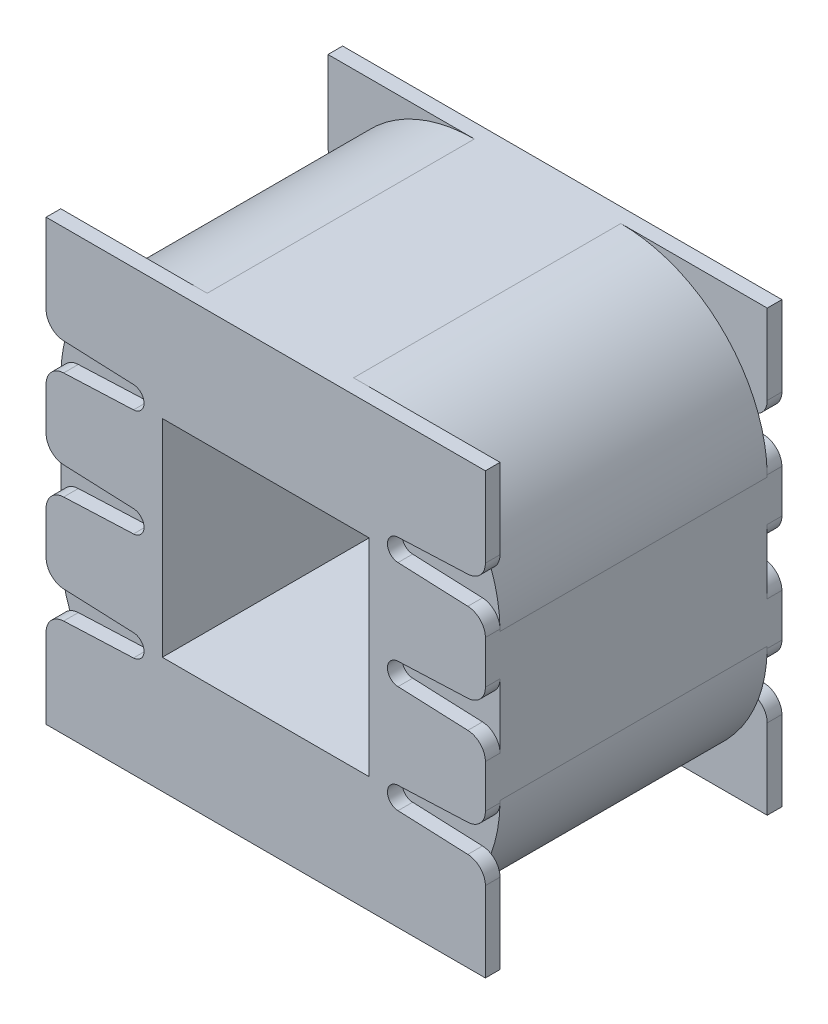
SolidWorks part; units mm, degrees
ref_plane "Face" through (0, 0, 0) normal (0, 0, 1) x (1, 0, 0)
ref_plane "Dessus" through (0, 0, 0) normal (0, 1, 0) x (1, 0, 0)
ref_plane "Droite" through (0, 0, 0) normal (1, 0, 0) x (0, 0, -1)
sketch "Esquisse1" plane through (0, 0, 0) normal (0, 0, 1) x (1, 0, 0)
  line L0 (0, 0) -> (42.7473, 0) construction
  line L1 (-12, 12) -> (12, 12)
  line L2 (-12, 12) -> (-12, 7.629)
  line L3 (-12, -12) -> (12, -12)
  line L4 (12, 12) -> (12, 7.629)
  line L5 (0, 0) -> (0, 46.2729) construction
  line L6 (7.2254, 0.6) -> (11.0419, 0.7599)
  line L7 (-5.65, 5.65) -> (5.65, 5.65)
  line L8 (-5.65, 5.65) -> (-5.65, -5.65)
  line L9 (-5.65, -5.65) -> (5.65, -5.65)
  line L10 (5.65, 5.65) -> (5.65, -5.65)
  line L11 (12, -1.759) -> (12, -4.111)
  line L12 (7.2254, -0.6) -> (11.0419, -0.7599)
  line L13 (7.2254, 6.47) -> (11.0419, 6.6299)
  line L14 (7.2254, 5.27) -> (11.0419, 5.1101)
  line L15 (7.2254, -5.27) -> (11.0419, -5.1101)
  line L16 (7.2254, -6.47) -> (11.0419, -6.6299)
  line L17 (12, 4.111) -> (12, 1.759)
  line L18 (12, -7.629) -> (12, -12)
  line L19 (-7.2254, -6.47) -> (-11.0419, -6.6299)
  line L20 (-7.2254, -5.27) -> (-11.0419, -5.1101)
  line L21 (-7.2254, -0.6) -> (-11.0419, -0.7599)
  line L22 (-7.2254, 0.6) -> (-11.0419, 0.7599)
  line L23 (-7.2254, 5.27) -> (-11.0419, 5.1101)
  line L24 (-7.2254, 6.47) -> (-11.0419, 6.6299)
  line L25 (-12, 4.111) -> (-12, 1.759)
  line L26 (-12, -1.759) -> (-12, -4.111)
  line L27 (-12, -7.629) -> (-12, -12)
  arc A0 (7.2254, 0.6) -> (7.2254, -0.6) centre (7.2505, 0) ccw
  arc A1 (11.0419, 0.7599) -> (12, 1.759) centre (11, 1.759) ccw
  arc A2 (11.0419, -0.7599) -> (12, -1.759) centre (11, -1.759) cw
  arc A3 (7.2254, 6.47) -> (7.2254, 5.27) centre (7.2505, 5.87) ccw
  arc A4 (11.0419, 6.6299) -> (12, 7.629) centre (11, 7.629) ccw
  arc A5 (11.0419, 5.1101) -> (12, 4.111) centre (11, 4.111) cw
  arc A6 (7.2254, -5.27) -> (7.2254, -6.47) centre (7.2505, -5.87) ccw
  arc A7 (11.0419, -5.1101) -> (12, -4.111) centre (11, -4.111) ccw
  arc A8 (11.0419, -6.6299) -> (12, -7.629) centre (11, -7.629) cw
  arc A9 (-11.0419, -6.6299) -> (-12, -7.629) centre (-11, -7.629) ccw
  arc A10 (-11.0419, -5.1101) -> (-12, -4.111) centre (-11, -4.111) cw
  arc A11 (-7.2254, -5.27) -> (-7.2254, -6.47) centre (-7.2505, -5.87) cw
  arc A12 (-11.0419, -0.7599) -> (-12, -1.759) centre (-11, -1.759) ccw
  arc A13 (-11.0419, 0.7599) -> (-12, 1.759) centre (-11, 1.759) cw
  arc A14 (-7.2254, 0.6) -> (-7.2254, -0.6) centre (-7.2505, 0) cw
  arc A15 (-11.0419, 5.1101) -> (-12, 4.111) centre (-11, 4.111) ccw
  arc A16 (-11.0419, 6.6299) -> (-12, 7.629) centre (-11, 7.629) cw
  arc A17 (-7.2254, 6.47) -> (-7.2254, 5.27) centre (-7.2505, 5.87) cw
  point P6 (0, 12)
  point P13 (0, 5.65)
  point P14 (5.65, 0)
  point P21 (12, 0.8)
  dimension "D3" = 1
  dimension "D6" = 1
  dimension "D1" = 24
  dimension "D2" = 11.3
  dimension "D4" = 1.2
  dimension "D5" = 1.6
extrude "Extrusion1" add sketch "Esquisse1" along normal blind 16.2
ref_plane "Plan1" through (0, 0, 8.1) normal (0, 0, 1) x (1, 0, 0)
sketch "Esquisse2" plane through (0, 0, 8.1) normal (0, 0, 1) x (1, 0, 0)
  line L8 (6.65, 6.65) -> (-6.65, 6.65)
  line L9 (-6.65, 6.65) -> (-6.65, -6.65)
  line L10 (-6.65, -6.65) -> (6.65, -6.65)
  line L11 (6.65, -6.65) -> (6.65, 6.65)
extrude "Enlèv. mat.-Extru.1" cut sketch "Esquisse2" against normal offset from surface 0.8 and the other way offset from surface (7.3 mm away) 0.8 flip side to cut
sketch "Esquisse3" plane through (0, 0, 8.1) normal (0, 0, 1) x (1, 0, 0)
  line L0 (-5.65, 5.65) -> (-5.65, -5.65) construction
  line L1 (-5.65, -5.65) -> (5.65, -5.65) construction
  line L2 (5.65, -5.65) -> (5.65, 5.65) construction
  line L3 (5.65, 5.65) -> (-5.65, 5.65) construction
  line L4 (-5.65, 5.65) -> (-5.65, -5.65)
  line L5 (-5.65, -5.65) -> (5.65, -5.65)
  line L6 (5.65, -5.65) -> (5.65, 5.65)
  line L7 (5.65, 5.65) -> (-5.65, 5.65)
  line L8 (-12, -12) -> (12, -12) construction
  line L9 (12, 7.629) -> (12, 12) construction
  line L10 (-12, 12) -> (-12, 7.629) construction
  line L11 (12, 12) -> (-12, 12) construction
  line L12 (-4, -12) -> (4, -12)
  line L13 (12, -4) -> (12, 4)
  line L14 (-12, 4) -> (-12, -4)
  line L15 (4, 12) -> (-4, 12)
  arc A0 (-12, 4) -> (-4, 12) centre (-4, 4) cw
  arc A1 (12, 4) -> (4, 12) centre (4, 4) ccw
  arc A2 (4, -12) -> (12, -4) centre (4, -4) ccw
  arc A3 (-4, -12) -> (-12, -4) centre (-4, -4) cw
  dimension "D1" = 8
extrude "Extrusion2" add sketch "Esquisse3" along normal up to surface and the other way up to surface
sketch "Esquisse4" plane through (0, 0, 0.8) normal (0, 0, -1) x (-1, 0, 0)
  circle A0 centre (7.1818, -6.05) radius 0.1534
sketch "Esquisse5" plane through (0, 0, 0.8) normal (0, 0, -1) x (-1, 0, 0)
  circle A0 centre (7.6956, 5.9959) radius 0.205
